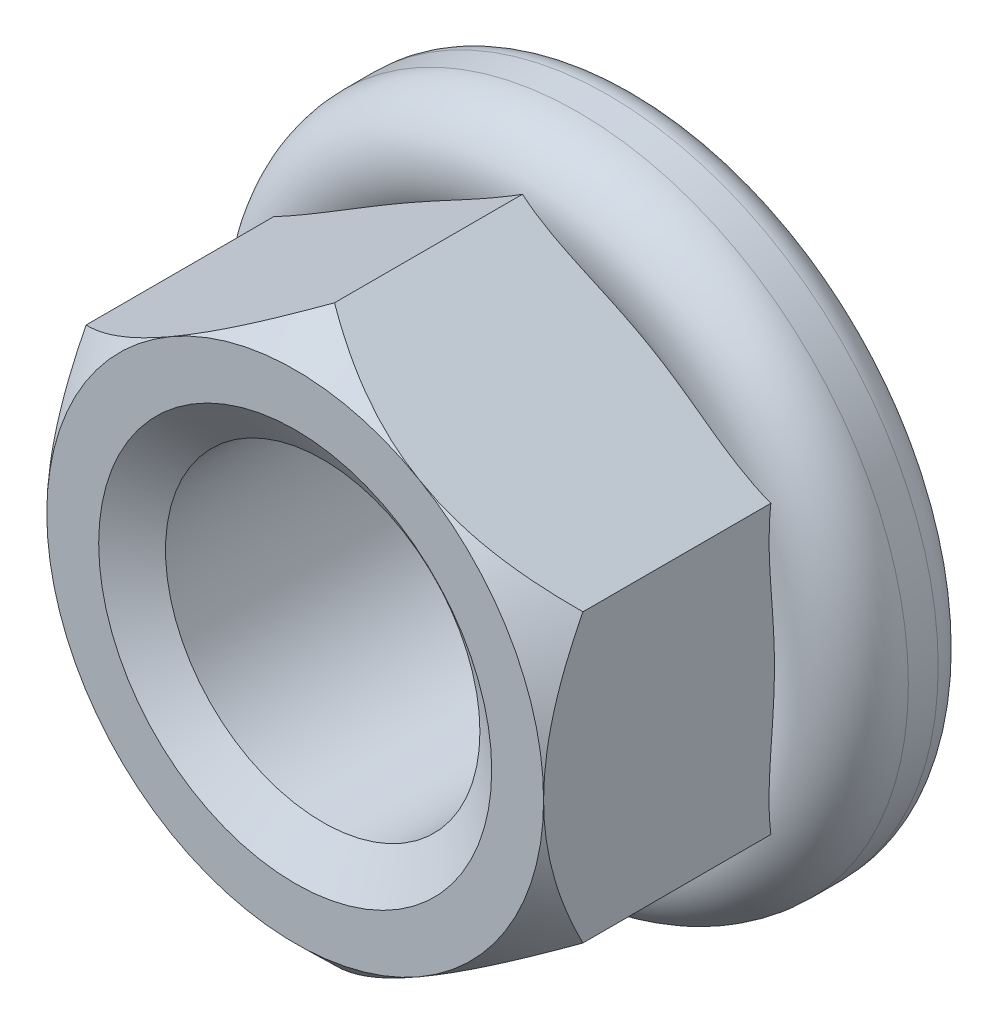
SolidWorks part; units mm, degrees
extrude "BaseNut" add sketch "BaseNutSke" against normal blind 5.5626
sketch "BaseNutSke" plane through (0, 0, 0) normal (0, 0, 1) x (1, 0, 0)
  line L6 (4.0132, 2.317) -> (4.0132, -2.317)
  line L7 (-4.0132, 2.317) -> (-4.0132, -2.317)
  line L8 (4.0132, 2.317) -> (0, 4.634)
  line L9 (0, 4.634) -> (-4.0132, 2.317)
  line L10 (-4.0132, -2.317) -> (0, -4.634)
  line L11 (0, -4.634) -> (4.0132, -2.317)
  circle A0 centre (0, 0) radius 2.54
ref_plane "Plane1" through (0, 0, 0) normal (0, 0, 1) x (1, 0, 0)
ref_plane "Plane2" through (0, 0, 0) normal (0, 1, 0) x (1, 0, 0)
ref_plane "Plane3" through (0, 0, 0) normal (1, 0, 0) x (0, 0, -1)
other "Configuration Table"
sketch "Sketch4" plane through (0, 0, 0) normal (1, 0, 0) x (0, 0, -1)
  line L0 (5.5626, 4.0132) -> (5.1562, 4.0132)
  line L1 (5.5626, 4.0132) -> (5.5626, 17.334)
  line L2 (5.1562, 17.334) -> (5.5626, 17.334)
  line L3 (5.1562, 17.334) -> (5.1562, 4.0132)
  line L4 (0, 0) -> (34.925, 0) construction
  line L6 (5.5626, 2.317) -> (5.5626, 4.634) construction
  line L7 (0, 4.0132) -> (-12.7, 4.0132)
  line L8 (0, 2.317) -> (0, 4.634) construction
  line L9 (0.635, 4.634) -> (0.635, 17.334)
  line L10 (0.635, 17.334) -> (-12.7, 17.334)
  line L11 (-12.7, 17.334) -> (-12.7, 4.0132)
  line L12 (0, 4.0132) -> (0.635, 4.634)
  line L14 (0, 2.317) -> (0, -2.317) construction
  line L15 (5.5626, 4.634) -> (0, 4.634) construction
revolve "Bearing-Face" [suppressed] cut sketch "Sketch4" angle 360 about L4
sketch "Sketch3" plane through (0, 0, 0) normal (1, 0, 0) x (0, 0, -1)
  line L0 (5.5626, 4.0132) -> (4.9276, 4.634) construction
  line L1 (4.9276, 4.634) -> (4.9276, 17.334) construction
  line L2 (4.9276, 17.334) -> (18.2626, 17.334) construction
  line L3 (18.2626, 17.334) -> (18.2626, 4.0132) construction
  line L4 (18.2626, 4.0132) -> (5.5626, 4.0132) construction
  line L5 (5.5626, 2.317) -> (5.5626, 4.634) construction
  line L6 (5.5626, 4.634) -> (0, 4.634) construction
  line L7 (0, 0) -> (38.6776, 0) construction
  line L8 (5.5626, 0) -> (0, 0) construction
  line L9 (2.7813, 4.634) -> (2.7813, 44.222) construction
  line L10 (0.635, 17.334) -> (-12.7, 17.334)
  line L11 (-12.7, 17.334) -> (-12.7, 4.0132)
  line L12 (-12.7, 4.0132) -> (0, 4.0132)
  line L13 (0, 4.0132) -> (0.635, 4.634)
  line L14 (0.635, 4.634) -> (0.635, 17.334)
  line L16 (5.5626, 4.634) -> (0, 4.634) construction
revolve "Double-Chamfer" cut sketch "Sketch3" angle 360 about L7
sketch "EndChamferSke" plane through (0, 0, 0) normal (1, 0, 0) x (0, 0, -1)
  line L0 (5.5372, 3.175) -> (5.0481, 2.4765)
  line L1 (5.588, 3.175) -> (5.5372, 3.175)
  line L2 (5.588, 3.175) -> (5.588, 2.4765)
  line L3 (5.588, 2.4765) -> (5.0481, 2.4765)
  line L6 (-0.0508, 3.175) -> (0, 3.175)
  line L7 (0, 3.175) -> (0.4891, 2.4765)
  line L9 (0.4891, 2.4765) -> (-0.0508, 2.4765)
  line L10 (-0.0508, 2.4765) -> (-0.0508, 3.175)
  line L11 (25.0375, 0) -> (38.388, 0) construction
sketch "ThdSchSke" plane through (0, 0, 0) normal (0, 1, 0) x (1, 0, 0)
  line L0 (-3.175, 0.0254) -> (-2.54, 0.47)
  line L1 (-2.54, 0.47) -> (-1.27, 0.47)
  line L2 (-1.27, 0.47) -> (-1.27, -0.4192)
  line L3 (-1.27, -0.4192) -> (-2.54, -0.4192)
  line L4 (-2.54, -0.4192) -> (-3.175, 0.0254)
  line L6 (0, 0.4788) -> (0, -2.9874) construction
  line L7 (3.175, 0.4788) -> (15.875, 0.4788) construction
revolve "EndChamfer" cut sketch "EndChamferSke" angle 360 about L11
revolve "ThreadSchematic" [suppressed] cut sketch "ThdSchSke" angle 360 about L6
pattern_linear "ThdSchPat" [suppressed]
sketch "Sketch5" plane through (0, 0, 0) normal (1, 0, 0) x (0, 0, -1)
  line L0 (5.5626, 3.4755) -> (5.5626, 4.826)
  line L1 (5.0546, 5.334) -> (4.572, 5.334)
  line L2 (4.572, 3.4755) -> (5.5626, 3.4755)
  line L3 (-4.4998, 0) -> (10.8386, 0) construction
  line L4 (5.5626, 4.634) -> (5.5626, 2.317) construction
  line L8 (5.5626, 2.317) -> (5.5626, 4.634) construction
  arc A0 (4.572, 5.334) -> (4.572, 3.4755) centre (4.572, 4.4048) ccw
  arc A1 (5.5626, 4.826) -> (5.0546, 5.334) centre (5.0546, 4.826) ccw
  dimension "A_dia" = 10.668
  dimension "B_dia" = 9.652
  dimension "J" = 0.4826
revolve "Revolve1" add sketch "Sketch5" angle 360 about L3
equation "\"D2@BaseNutSke\" = \"Width_flats@BaseNutSke\" / 2"
equation "\"D3@BaseNutSke\" = \"Width_flats@BaseNutSke\" / 2"
equation "\"D1@Sketch3\" = \"Width_flats@BaseNutSke\" /2"
equation "\"D2@Sketch3\" = \"Thread_major@ThreadCosmetic\" *.1"
equation "\"D1@Sketch4\" = \"D2@BaseNutSke\""
equation "\"D2@Sketch4\" = \"Thread_major@ThreadCosmetic\" *.10"
equation "\"D4@BaseNutSke\" = \"D3@BaseNutSke\""
equation "\"Thread_major@ThdSchSke\" = \"Thread_major@ThreadCosmetic\""
equation "\"Tap_drill@ThdSchSke\" = \"Thread_min@BaseNutSke\""
equation "\"OverCut@ThdSchSke\" = \"Tap_drill@ThdSchSke\" * 0.5"
equation "\"Num_threads@ThdSchPat\" = int(  ( \"Thickness@BaseNut\" - 0.002 ) / \"Advance@ThdSchSke\" + 0.999 )  + 1"
equation "\"Advance@ThdSchPat\" = ( \"Thickness@BaseNut\" - 0.002 ) /  (\"Num_threads@ThdSchPat\" - 1) 'relax it"
equation "' \"Num_threads@ThdSchPat\" = \"Num_threads@ThdSchPat\" - sgn( \"Num_threads@ThdSchPat\" - 1) '---chamfered tips only---"
equation "\"ThreadMajor@EndChamferSke\" = \"Thread_major@ThreadCosmetic\" * 0.5"
equation "\"ChamferDepth@EndChamferSke\" = (\"Thread_major@ThreadCosmetic\" - \"Thread_min@BaseNutSke\") * 0.55"
equation "\"Offset1@EndChamferSke\" = \"Thickness@BaseNut\" + 0.001"
equation "\"Offset2@EndChamferSke\" = \"Offset1@EndChamferSke\" + 0.002"
